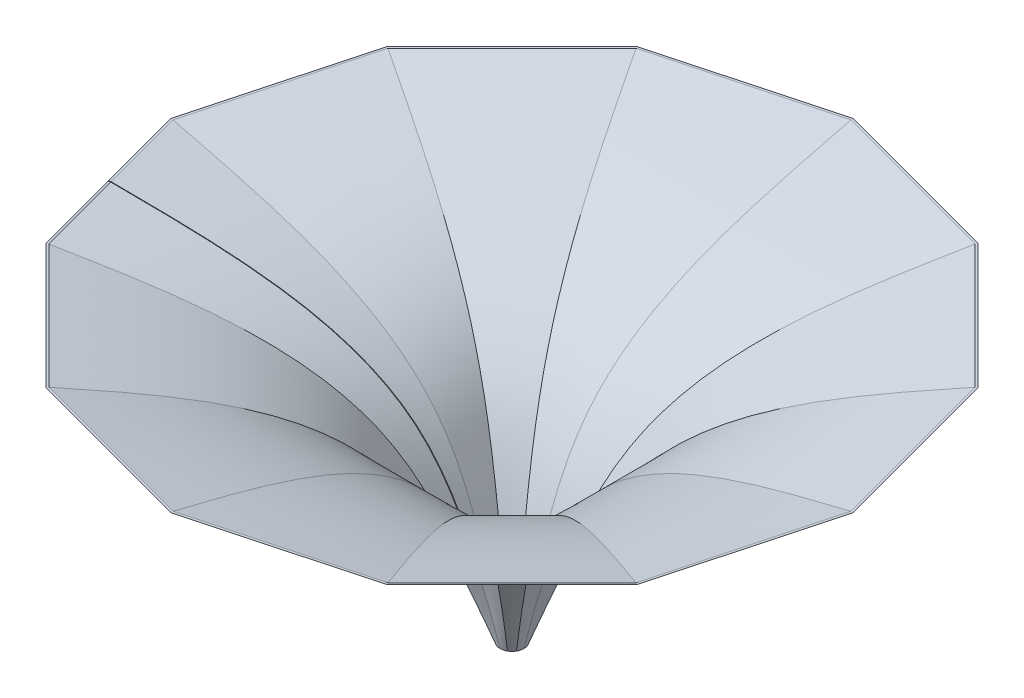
SolidWorks part; units mm, degrees
ref_plane "Ebene vorne" through (0, 0, 0) normal (0, 0, 1) x (1, 0, 0)
ref_plane "Ebene oben" through (0, 0, 0) normal (0, 1, 0) x (1, 0, 0)
ref_plane "Ebene rechts" through (0, 0, 0) normal (1, 0, 0) x (0, 0, -1)
sketch "Mittellinie" plane through (0, 0, 0) normal (0, 0, 1) x (1, 0, 0)
  line L0 (0, 0) -> (0, 2500)
  dimension "D1" = 2500
sketch "Skizze3" plane through (0, 0, 0) normal (0, 1, 0) x (1, 0, 0)
  circle A0 centre (0, 0) radius 100
  dimension "D1" = 200
ref_plane "Ebene1" through (0, 2500, 0) normal (0, 1, 0) x (-1, 0, 0)
sketch "Skizze8" plane through (0, 2500, 0) normal (0, 1, 0) x (-1, 0, 0)
  line L1 (0, 3000) -> (-1500, 2598.0762)
  line L2 (-1500, 2598.0762) -> (-2598.0762, 1500)
  line L3 (-2598.0762, 1500) -> (-3000, 0)
  line L4 (-3000, 0) -> (-2598.0762, -1500)
  line L5 (-2598.0762, -1500) -> (-1500, -2598.0762)
  line L6 (-1500, -2598.0762) -> (0, -3000)
  line L7 (0, -3000) -> (1500, -2598.0762)
  line L8 (1500, -2598.0762) -> (2598.0762, -1500)
  line L9 (2598.0762, -1500) -> (3000, 0)
  line L10 (3000, 0) -> (2598.0762, 1500)
  line L11 (2598.0762, 1500) -> (1500, 2598.0762)
  line L12 (1500, 2598.0762) -> (0, 3000)
  circle A0 centre (0, 0) radius 3000 construction
sketch "Skizze9" plane through (0, 0, 0) normal (0, 0, 1) x (1, 0, 0)
  line L2 (0, 0) -> (0, 3211.7173) construction
  spline S0 degree 3 poles (3000, 2500) (2068.8289, 2272.0752) (597.8543, 1912.0216) (233.6515, 513.2918) (100, 0) knots 0 0 0 0 0.63303 1 1 1 1
  spline S1 degree 3 poles (-3000, 2500) (-2068.8289, 2272.0752) (-597.8543, 1912.0216) (-233.6515, 513.2918) (-100, 0) knots 0 0 0 0 0.63303 1 1 1 1
  dimension "D1" = 1300
  dimension "D2" = 1400
sketch "Skizze11" plane through (0, 0, 0) normal (1, 0, 0) x (0, 0, -1)
  line L3 (0, 0) -> (0, 3699.5144) construction
  line L4 (100, 0) -> (-100, 0) construction
  spline S0 degree 3 poles (3000, 2500) (2068.8289, 2272.0752) (597.8543, 1912.0216) (233.6515, 513.2918) (100, 0) knots 0 0 0 0 0.63303 1 1 1 1
  spline S1 degree 3 poles (-3000, 2500) (-2068.8289, 2272.0752) (-597.8543, 1912.0216) (-233.6515, 513.2918) (-100, 0) knots 0 0 0 0 0.63303 1 1 1 1
  dimension "D1" = 1300
  dimension "D2" = 1400
loft "Ausformung-Dünn1" add profiles "Skizze8", "Skizze3" parameters "D1"=5
sketch "Skizze18" plane through (0, 2500, 0) normal (0, 1, 0) x (-1, 0, 0)
  line L12 (0, 3000) -> (-1500, 2598.0762)
  line L13 (-1500, 2598.0762) -> (-2598.0762, 1500)
  line L14 (-2598.0762, 1500) -> (-3000, 0)
  line L15 (-3000, 0) -> (-2598.0762, -1500)
  line L16 (-2598.0762, -1500) -> (-1500, -2598.0762)
  line L17 (-1500, -2598.0762) -> (0, -3000)
  line L18 (0, -3000) -> (1500, -2598.0762)
  line L19 (1500, -2598.0762) -> (2598.0762, -1500)
  line L20 (2598.0762, -1500) -> (3000, 0)
  line L21 (3000, 0) -> (2598.0762, 1500)
  line L22 (2598.0762, 1500) -> (1500, 2598.0762)
  line L23 (1500, 2598.0762) -> (0, 3000)
  line L33 (3000, 0) -> (2598.0762, 1500)
  dimension "D1" = 0
sketch3d "3D-Skizze1"
  spline S5 degree 3 poles (-1931.2542, 2499.9996, -3540.8609) (-140.6536, 2499.9996, -3058.8253) (1650.0183, 2499.9995, -2577.0546) (3440.7619, 2499.9994, -2095.5505) knots -1.27951 -1.27951 -1.27951 -1.27951 2.279509 2.279509 2.279509 2.279509 only from (0, 2499.9996, -3021.0711) to (1509.4093, 2499.9995, -2614.973)
  spline S6 degree 3 number of poles 78 (1509.4093, 2499.9995, -2614.973) -> (52.6881, 0, -91.2079)
  spline S7 degree 3 poles (-161.0253, 0, 1882.5612) (196.4546, 0, 523.0566) (217.0413, 0, -24.7596) (38.2215, 0, -98.1035) (36.0778, 0, -98.9028) (32.8195, 0, -99.999) (31.7262, 0, -100.3472) (29.5254, 0, -101.0089) (28.4167, 0, -101.3228) (25.0774, 0, -102.2093) (22.8362, 0, -102.7267) (18.3239, 0, -103.6151) (16.0514, 0, -103.9864) (-195.2308, 0, -131.4475) (-446.122, 0, 467.4726) (-741.7833, 0, 1735.4651) knots -10.19156 -10.19156 -10.19156 -10.19156 0.25 0.25 0.375 0.375 0.4375 0.4375 0.5 0.5 0.625 0.625 0.75 0.75 12.185783 12.185783 12.185783 12.185783 only from (52.6881, 0, -91.2079) to (0, 0, -105.1667)
  spline S8 degree 3 poles (0, -1825.7896, 679.6143) (0, -1235.9721, 196.5576) (0, -559.9763, 41.9352) (0, 147.2238, -143.6594) (0, 184.0047, -153.3814) (0, 257.494, -173.0833) (0, 294.2019, -183.0632) (0, 367.5055, -203.4157) (0, 404.1013, -213.7883) (0, 477.14, -235.0692) (0, 513.5829, -245.9774) (0, 568.0998, -262.8566) (0, 586.2479, -268.5694) (0, 622.4684, -280.1813) (0, 640.5433, -286.0812) (0, 694.6502, -304.0931) (0, 730.5648, -316.5169) (0, 802.0143, -342.3714) (0, 837.5493, -355.802) (0, 908.1665, -383.8648) (0, 943.2486, -398.4969) (0, 986.7663, -417.6757) (0, 995.453, -421.556) (0, 1008.4569, -427.446) (0, 1012.7872, -429.421) (0, 1021.4388, -433.3945) (0, 1025.761, -435.3935) (0, 1047.3342, -445.442) (0, 1064.4757, -453.6533) (0, 1115.5249, -478.8394) (0, 1149.0578, -496.3663) (0, 1214.9903, -533.0893) (0, 1247.3898, -552.2853) (0, 1310.911, -592.5594) (0, 1342.0326, -613.6373) (0, 1387.6386, -646.8395) (0, 1402.6598, -658.1732) (0, 1432.3297, -681.3892) (0, 1446.98, -693.269) (0, 1490.3814, -729.7179) (0, 1518.5827, -755.0965) (0, 1552.9348, -788.1445) (0, 1559.7603, -794.8203) (0, 1569.9314, -804.9328) (0, 1573.3108, -808.3203) (0, 1580.0395, -815.1203) (0, 1590.0904, -825.3605) (0, 1603.3244, -839.174) (0, 1614.7601, -851.3985) (0, 1620.4422, -857.5449) (0, 1623.2744, -860.6265) (0, 1624.4863, -861.9491) (0, 1654.013, -894.2033) (0, 1685.8598, -931.2557) (0.0035, 275.0205, 609.966) knots -1.076182 -1.076182 -1.076182 -1.076182 0.0625 0.0625 0.125 0.125 0.1875 0.1875 0.25 0.25 0.3125 0.3125 0.34375 0.34375 0.375 0.375 0.4375 0.4375 0.5 0.5 0.5625 0.5625 0.578125 0.578125 0.585937 0.585937 0.59375 0.59375 0.625 0.625 0.6875 0.6875 0.75 0.75 0.8125 0.8125 0.84375 0.84375 0.875 0.875 0.9375 0.9375 0.953125 0.953125 0.960937 0.960937 0.96875 0.984375 0.992187 0.996094 0.998047 0.999023 0.999023 1.069464 1.069464 1.069464 1.069464 only from (0, 0, -105.1667) to (0, 1626.099, -863.7121)
  spline S9 degree 3 poles (0.0042, 2972.2426, -2342.554) (0, 1562.6866, -796.3522) (0, 1598.931, -833.8989) (0, 1628.1785, -865.9917) (0, 1629.7379, -867.7049) (0, 1633.3683, -871.7087) (0, 1640.5966, -879.7408) (0, 1646.737, -886.6673) (0, 1658.9452, -900.5756) (0, 1666.9871, -909.9214) (0, 1690.8301, -938.1729) (0, 1706.3486, -957.2931) (0, 1751.8353, -1015.4646) (0, 1780.7356, -1055.3261) (0, 1815.2707, -1106.3591) (0, 1825.5119, -1121.7596) (0, 1835.579, -1137.2921) (0, 1842.2523, -1147.676) (0, 1845.571, -1152.884) (0, 1862.0554, -1178.9722) (0, 1874.893, -1199.9915) (0, 1912.4361, -1263.4616) (0, 1936.1739, -1306.3239) (0, 1981.4408, -1392.9874) (0, 2002.9695, -1436.7888) (0, 2044.1324, -1525.1971) (0, 2063.7663, -1569.8041) (0, 2101.41, -1659.7085) (0, 2119.4195, -1705.0061) (0, 2154.0504, -1796.1914) (0, 2170.6716, -1842.0792) (0, 2202.7348, -1934.3561) (0, 2218.1766, -1980.7453) (0, 2240.5959, -2050.6451) (0, 2247.9449, -2073.9978) (0, 2262.4167, -2120.7994) (0, 2269.5399, -2144.25) (0, 2290.5985, -2214.7219) (0, 2304.209, -2261.8155) (0, 2330.7428, -2356.1826) (0, 2343.666, -2403.4563) (0, 2381.6385, -2545.4861) (0, 2405.8939, -2640.4503) (0, 2441.54, -2783.0897) (0, 2453.2983, -2830.6686) (0, 2635.2381, -3570.6773) (0, 2793.6766, -4266.1841) (0, 3132.9536, -4914.3055) knots -0.052955 -0.052955 -0.052955 -0.052955 0.000977 0.000977 0.001953 0.003906 0.007812 0.015625 0.015625 0.03125 0.03125 0.0625 0.0625 0.125 0.125 0.140625 0.148437 0.148437 0.15625 0.15625 0.1875 0.1875 0.25 0.25 0.3125 0.3125 0.375 0.375 0.4375 0.4375 0.5 0.5 0.5625 0.5625 0.59375 0.59375 0.625 0.625 0.6875 0.6875 0.75 0.75 0.875 0.875 0.9375 0.9375 1.846777 1.846777 1.846777 1.846777 only from (0, 1626.099, -863.7121) to (0, 2499.9996, -3021.0711)
  spline S10 degree 3 poles (0, 2499.9996, -3021.0711) (503.1308, 2499.9995, -2885.6841) (1006.2672, 2499.9995, -2750.3181) (1509.4093, 2499.9995, -2614.973) knots 0 0 0 0 1 1 1 1
  spline S11 degree 3 number of poles 78 (1509.4093, 2499.9995, -2614.973) -> (52.6881, 0, -91.2079)
  spline S12 degree 3 poles (52.6881, 0, -91.2079) (48.6854, 0, -93.4928) (44.5677, 0, -95.5005) (38.2215, 0, -98.1035) (36.0778, 0, -98.9028) (32.8195, 0, -99.999) (31.7262, 0, -100.3472) (29.5254, 0, -101.0089) (28.4167, 0, -101.3228) (25.0774, 0, -102.2093) (22.8362, 0, -102.7267) (18.3239, 0, -103.6151) (16.0514, 0, -103.9864) (9.198, 0, -104.8771) (4.609, 0, -105.1718) (0, 0, -105.1667) knots 0 0 0 0 0.25 0.25 0.375 0.375 0.4375 0.4375 0.5 0.5 0.625 0.625 0.75 0.75 1 1 1 1
  spline S13 degree 3 poles (0, 0, -105.1667) (0, 36.8156, -114.753) (0, 73.6296, -124.3457) (0, 147.2238, -143.6594) (0, 184.0047, -153.3814) (0, 257.494, -173.0833) (0, 294.2019, -183.0632) (0, 367.5055, -203.4157) (0, 404.1013, -213.7883) (0, 477.14, -235.0692) (0, 513.5829, -245.9774) (0, 568.0998, -262.8566) (0, 586.2479, -268.5694) (0, 622.4684, -280.1813) (0, 640.5433, -286.0812) (0, 694.6502, -304.0931) (0, 730.5648, -316.5169) (0, 802.0143, -342.3714) (0, 837.5493, -355.802) (0, 908.1665, -383.8648) (0, 943.2486, -398.4969) (0, 986.7663, -417.6757) (0, 995.453, -421.556) (0, 1008.4569, -427.446) (0, 1012.7872, -429.421) (0, 1021.4388, -433.3945) (0, 1025.761, -435.3935) (0, 1047.3342, -445.442) (0, 1064.4757, -453.6533) (0, 1115.5249, -478.8394) (0, 1149.0578, -496.3663) (0, 1214.9903, -533.0893) (0, 1247.3898, -552.2853) (0, 1310.911, -592.5594) (0, 1342.0326, -613.6373) (0, 1387.6386, -646.8395) (0, 1402.6598, -658.1732) (0, 1432.3297, -681.3892) (0, 1446.98, -693.269) (0, 1490.3814, -729.7179) (0, 1518.5827, -755.0965) (0, 1552.9348, -788.1445) (0, 1559.7603, -794.8203) (0, 1569.9314, -804.9328) (0, 1573.3108, -808.3203) (0, 1580.0395, -815.1203) (0, 1590.0904, -825.3605) (0, 1603.3244, -839.174) (0, 1614.7601, -851.3985) (0, 1620.4422, -857.5449) (0, 1623.2744, -860.6265) (0, 1624.4863, -861.9491) (0, 1625.2938, -862.8312) (0, 1625.6981, -863.2732) (0, 1626.099, -863.7121) knots 0 0 0 0 0.0625 0.0625 0.125 0.125 0.1875 0.1875 0.25 0.25 0.3125 0.3125 0.34375 0.34375 0.375 0.375 0.4375 0.4375 0.5 0.5 0.5625 0.5625 0.578125 0.578125 0.585937 0.585937 0.59375 0.59375 0.625 0.625 0.6875 0.6875 0.75 0.75 0.8125 0.8125 0.84375 0.84375 0.875 0.875 0.9375 0.9375 0.953125 0.953125 0.960937 0.960937 0.96875 0.984375 0.992187 0.996094 0.998047 0.999023 0.999023 1 1 1 1
  spline S14 degree 3 poles (0, 1626.099, -863.7121) (0, 1626.6155, -864.2774) (0, 1627.1381, -864.8501) (0, 1628.1785, -865.9917) (0, 1629.7379, -867.7049) (0, 1633.3683, -871.7087) (0, 1640.5966, -879.7408) (0, 1646.737, -886.6673) (0, 1658.9452, -900.5756) (0, 1666.9871, -909.9214) (0, 1690.8301, -938.1729) (0, 1706.3486, -957.2931) (0, 1751.8353, -1015.4646) (0, 1780.7356, -1055.3261) (0, 1815.2707, -1106.3591) (0, 1825.5119, -1121.7596) (0, 1835.579, -1137.2921) (0, 1842.2523, -1147.676) (0, 1845.571, -1152.884) (0, 1862.0554, -1178.9722) (0, 1874.893, -1199.9915) (0, 1912.4361, -1263.4616) (0, 1936.1739, -1306.3239) (0, 1981.4408, -1392.9874) (0, 2002.9695, -1436.7888) (0, 2044.1324, -1525.1971) (0, 2063.7663, -1569.8041) (0, 2101.41, -1659.7085) (0, 2119.4195, -1705.0061) (0, 2154.0504, -1796.1914) (0, 2170.6716, -1842.0792) (0, 2202.7348, -1934.3561) (0, 2218.1766, -1980.7453) (0, 2240.5959, -2050.6451) (0, 2247.9449, -2073.9978) (0, 2262.4167, -2120.7994) (0, 2269.5399, -2144.25) (0, 2290.5985, -2214.7219) (0, 2304.209, -2261.8155) (0, 2330.7428, -2356.1826) (0, 2343.666, -2403.4563) (0, 2381.6385, -2545.4861) (0, 2405.8939, -2640.4503) (0, 2441.54, -2783.0897) (0, 2453.2983, -2830.6686) (0, 2476.7013, -2925.8561) (0, 2488.347, -2973.4645) (0, 2499.9996, -3021.0711) knots 0 0 0 0 0.000977 0.000977 0.001953 0.003906 0.007812 0.015625 0.015625 0.03125 0.03125 0.0625 0.0625 0.125 0.125 0.140625 0.148437 0.148437 0.15625 0.15625 0.1875 0.1875 0.25 0.25 0.3125 0.3125 0.375 0.375 0.4375 0.4375 0.5 0.5 0.5625 0.5625 0.59375 0.59375 0.625 0.625 0.6875 0.6875 0.75 0.75 0.875 0.875 0.9375 0.9375 1 1 1 1
  dimension "D1" = 0
sketch3d "3D-Skizze2"
  spline S0 degree 3 number of poles 78 (2614.973, 2499.9995, 1509.4093) -> (91.2079, 0, 52.6881) construction
  spline S1 degree 3 number of poles 78 (2614.973, 2499.9995, 1509.4093) -> (91.2079, 0, 52.6881)
sketch3d "3D-Skizze3"
  spline S0 degree 3 number of poles 78 (1509.4093, 2499.9995, 2614.973) -> (52.6881, 0, 91.2079) construction
  spline S1 degree 3 number of poles 78 (1509.4093, 2499.9995, 2614.973) -> (52.6881, 0, 91.2079)
ref_plane "Ebene2" through (0, 0, 0) normal (0.2588, 0, 0.9659) x (0.9659, 0, -0.2588)
ref_plane "Ebene3" through (0, 0, 0) normal (-0.9659, 0, 0.2588) x (0.2588, 0, 0.9659)
ref_plane "Ebene5" through (-2799.0381, 0, 750) normal (-0.9659, 0, 0.2588) x (0.2588, 0, 0.9659)
sketch "Skizze17" plane through (0, 0, 0) normal (0.2588, 0, 0.9659) x (0.9659, 0, -0.2588)
  line L1 (0, 2821.8335) -> (-3254.5652, 2821.8335)
  line L2 (0, 2821.8335) -> (0, -344.2365)
  line L3 (0, -344.2365) -> (-3254.5652, -344.2365)
  line L4 (-3254.5652, 2821.8335) -> (-3254.5652, -344.2365)
extrude "Linear austragen5" cut sketch "Skizze17" against normal mid plane 5
sketch "Skizze20" plane through (-2799.0381, 0, 750) normal (-0.9659, 0, 0.2588) x (0.2588, 0, 0.9659)
  line L1 (776.4571, 2500) -> (-776.4571, 2500)
  line L2 (776.4571, 2500) -> (776.4571, -3798.789)
  line L3 (776.4571, -3798.789) -> (-776.4571, -3798.789)
  line L4 (-776.4571, 2500) -> (-776.4571, -3798.789)
  dimension "Dicke" = 4
